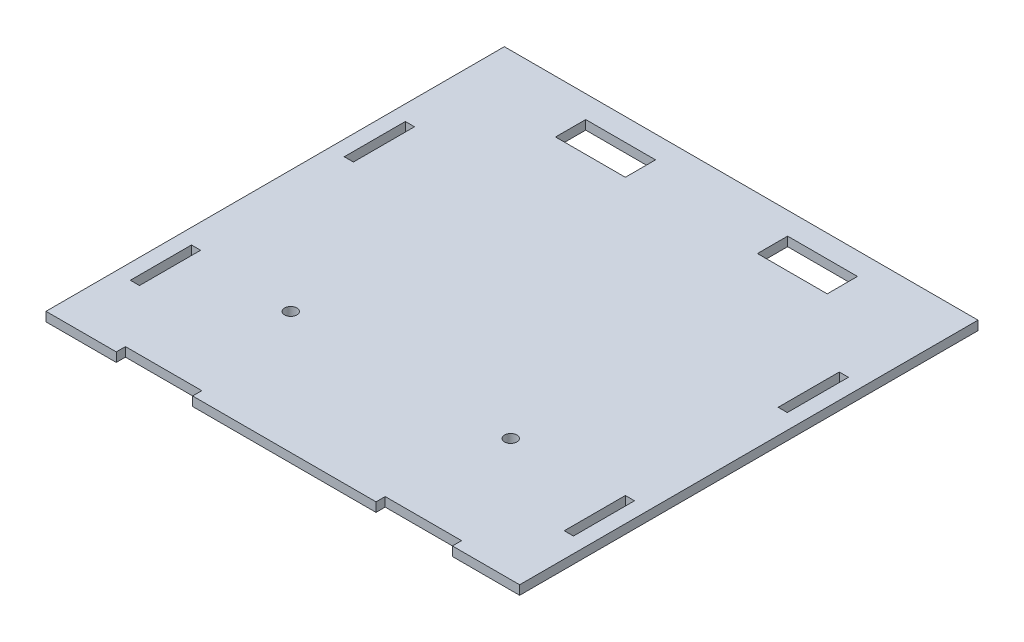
SolidWorks part; units mm, degrees
ref_plane "Front Plane" through (0, 0, 0) normal (0, 0, 1) x (1, 0, 0)
ref_plane "Top Plane" through (0, 0, 0) normal (0, 1, 0) x (1, 0, 0)
ref_plane "Right Plane" through (0, 0, 0) normal (1, 0, 0) x (0, 0, -1)
sketch "Sketch2" plane through (0, 0, 0) normal (0, 1, 0) x (1, 0, 0)
  line L1 (-77.5, 75) -> (77.5, 75)
  line L2 (-77.5, 75) -> (-77.5, -75)
  line L3 (-77.5, -75) -> (77.5, -75)
  line L4 (77.5, 75) -> (77.5, -75)
  line L5 (-77.5, 75) -> (77.5, -75) construction
  line L6 (-77.5, -75) -> (77.5, 75) construction
  point P0 (0, 0)
  dimension "D1" = 150
  dimension "D2" = 155
extrude "Boss-Extrude1" add sketch "Sketch2" along normal blind 3
sketch "Sketch3" plane through (0, 0, 0) normal (0, -1, 0) x (1, 0, 0)
  line L0 (-77.5, 75) -> (77.5, 75) construction
  line L1 (69.5, -17.595) -> (72.5, -17.595)
  line L2 (69.5, -17.595) -> (69.5, -37.595)
  line L3 (69.5, -37.595) -> (72.5, -37.595)
  line L4 (72.5, -17.595) -> (72.5, -37.595)
  line L5 (72.5, 32.405) -> (69.5, 32.405)
  line L6 (72.5, 32.405) -> (72.5, 52.405)
  line L7 (72.5, 52.405) -> (69.5, 52.405)
  line L8 (69.5, 32.405) -> (69.5, 52.405)
  line L9 (55.5, 72) -> (30.5, 72)
  line L10 (55.5, 72) -> (55.5, 75)
  line L11 (55.5, 75) -> (30.5, 75)
  line L12 (30.5, 72) -> (30.5, 75)
  line L13 (30.5, 72) -> (30.5, 75) construction
  line L15 (-54.5, 72) -> (-29.5101, 72)
  line L16 (-54.5, 72) -> (-54.5, 75)
  line L17 (-54.5, 75) -> (-29.5101, 75)
  line L18 (-29.5101, 72) -> (-29.5101, 75)
  line L19 (-69.5, 32.405) -> (-72.5, 32.405)
  line L20 (-69.5, 32.405) -> (-69.5, 52.405)
  line L21 (-69.5, 52.405) -> (-72.5, 52.405)
  line L22 (-72.5, 32.405) -> (-72.5, 52.405)
  line L23 (-69.5, -17.595) -> (-72.5, -17.595)
  line L24 (-69.5, -17.595) -> (-69.5, -37.595)
  line L25 (-69.5, -37.595) -> (-72.5, -37.595)
  line L26 (-72.5, -17.595) -> (-72.5, -37.595)
  line L27 (45.3867, -57.7782) -> (22.539, -57.7782)
  line L28 (45.3867, -57.7782) -> (45.3867, -67.6582)
  line L29 (45.3867, -67.6582) -> (22.539, -67.6582)
  line L30 (22.539, -57.7782) -> (22.539, -67.6582)
  line L31 (-20.6864, -57.7782) -> (-43.5342, -57.7782)
  line L32 (-20.6864, -57.7782) -> (-20.6864, -67.6582)
  line L33 (-20.6864, -67.6582) -> (-43.5342, -67.6582)
  line L34 (-43.5342, -57.7782) -> (-43.5342, -67.6582)
  circle A0 centre (-37.4118, 35) radius 2
  circle A1 centre (34.5882, 35) radius 2
extrude "Cut-Extrude1" cut sketch "Sketch3" against normal blind 10
equation "\"sheet thickness\"= 3mm"
equation "\"D1@Boss-Extrude1\"=\"sheet thickness\""
